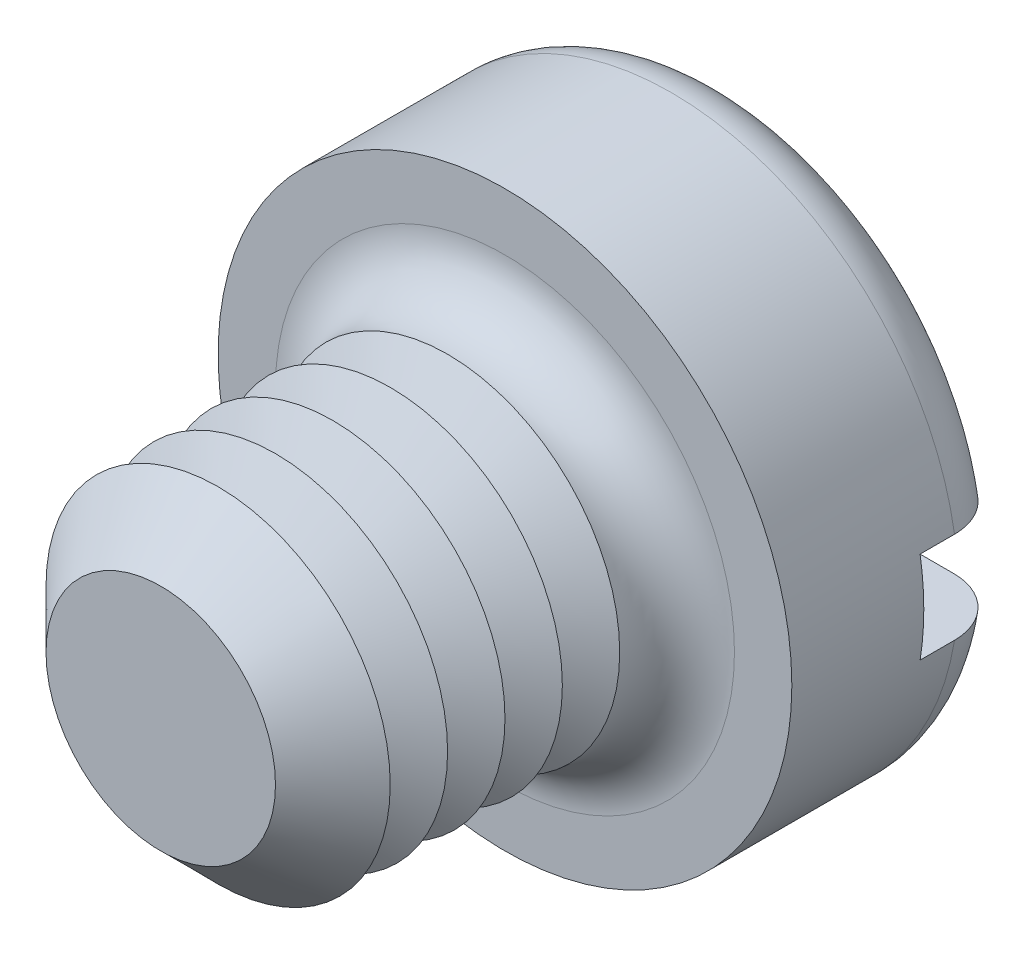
SolidWorks part; units mm, degrees
ref_plane "Front Plane" through (0, 0, 0) normal (0, 0, 1) x (1, 0, 0)
ref_plane "Top Plane" through (0, 0, 0) normal (0, 1, 0) x (1, 0, 0)
ref_plane "Right Plane" through (0, 0, 0) normal (1, 0, 0) x (0, 0, -1)
sketch "Sketch3" plane through (0, 0, 0) normal (0, 0, 1) x (1, 0, 0)
  circle A0 centre (0, 0) radius 5
  dimension "D1" = 10
extrude "Boss-Extrude2" add sketch "Sketch3" against normal blind 3.9
sketch "Sketch4" plane through (0, 0, 0) normal (0, 0, 1) x (1, 0, 0)
  circle A0 centre (0, 0) radius 3
  dimension "D1" = 6
extrude "Boss-Extrude3" add sketch "Sketch4" along normal blind 6
fillet "Fillet1" radius 1 2 edges at (5, 0, -3.9) (3, 0, 0)
chamfer "Chamfer1" distance 1 angle 45 1 edges at (3, 0, 6)
sketch "Sketch5" plane through (0, 0, 0) normal (1, 0, 0) x (0, 0, -1)
  line L0 (1.6944, 0) -> (-7.6738, 0) construction
sketch "Sketch6" plane through (0, 0, 0) normal (1, 0, 0) x (0, 0, -1)
  line L0 (-1, 3) -> (-1.5, 2.134)
  line L1 (-1.5, 2.134) -> (-2, 3)
  line L2 (-1, 3) -> (-5, 3) construction
  line L3 (-2, 3) -> (-1, 3)
  dimension "D1" = 1
revolve "Cut-Revolve1" cut sketch "Sketch6" angle 360 about L0
pattern_linear "LPattern1" count 4 spacing 1 along (0, 0, 1) of "Cut-Revolve1"
sketch "Sketch8" plane through (0, 0, -3.9) normal (0, 0, -1) x (-1, 0, 0)
  line L1 (5, -0.8) -> (-5, -0.8)
  line L2 (5, -0.8) -> (5, 0.8)
  line L3 (5, 0.8) -> (-5, 0.8)
  line L4 (-5, -0.8) -> (-5, 0.8)
  line L5 (5, -0.8) -> (-5, 0.8) construction
  line L6 (5, 0.8) -> (-5, -0.8) construction
  point P0 (0, 0)
  dimension "D1" = 10
  dimension "D2" = 1.6
extrude "Cut-Extrude1" cut sketch "Sketch8" against normal blind 1.6
